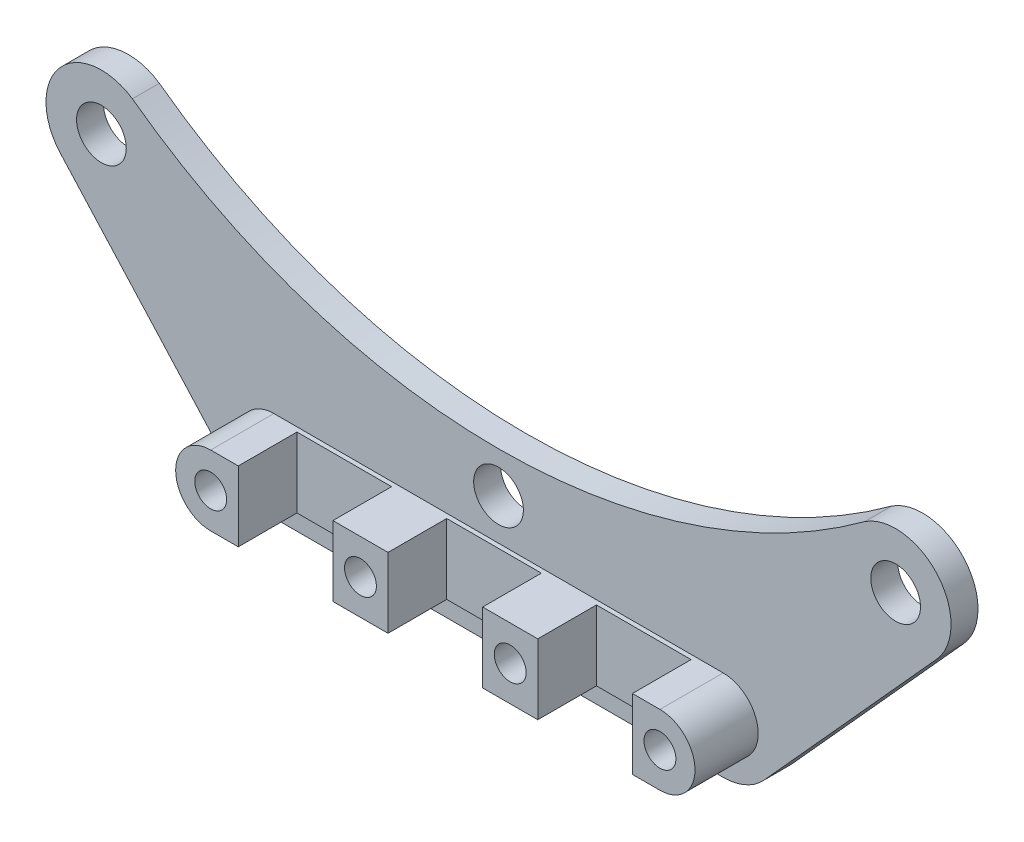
SolidWorks part; units mm, degrees
ref_plane "Front" through (0, 0, 0) normal (0, 0, 1) x (1, 0, 0)
ref_plane "Top" through (0, 0, 0) normal (0, 1, 0) x (1, 0, 0)
ref_plane "Right" through (0, 0, 0) normal (1, 0, 0) x (0, 0, -1)
sketch "Sketch1" plane through (0, 0, 0) normal (0, 0, 1) x (1, 0, 0)
  line L0 (205.3219, 64.3412) -> (219.9514, 48.1514)
  line L1 (279.6538, 64.3412) -> (265.0243, 48.1514)
  line L2 (261.5379, 46.6029) -> (223.4379, 46.6029)
  arc A0 (211.4358, 71.3874) -> (273.54, 71.3874) centre (242.4879, 113.6589) ccw
  arc A1 (219.9514, 48.1514) -> (223.4379, 46.6029) centre (223.4379, 51.3019) ccw
  arc A2 (211.716, 71.1831) -> (204.1094, 67.4916) centre (208.8084, 67.4916) ccw
  arc A3 (204.1094, 67.4916) -> (205.3219, 64.3412) centre (208.8084, 67.4916) ccw
  circle A4 centre (223.4379, 51.3019) radius 1.778 construction
  arc A5 (261.5379, 46.6029) -> (265.0243, 48.1514) centre (261.5379, 51.3019) ccw
  circle A6 centre (236.1379, 51.3019) radius 1.778 construction
  circle A7 centre (248.8379, 51.3019) radius 1.778 construction
  circle A8 centre (261.5379, 51.3019) radius 1.778 construction
  arc A9 (280.8664, 67.4916) -> (273.2598, 71.1831) centre (276.1674, 67.4916) ccw
  arc A10 (279.6538, 64.3412) -> (280.8664, 67.4916) centre (276.1674, 67.4916) ccw
  circle A11 centre (208.8084, 67.4916) radius 2.1082
  circle A12 centre (276.1674, 67.4916) radius 2.1082
  circle A13 centre (242.4879, 57.7535) radius 2.1082
extrude "Boss-Extrude1" add sketch "Sketch1" along normal blind 2.286 contours L1 A10 A9 A0 A2 A3 L0 A1 L2 A5 A13 A12 A11
sketch "Sketch2" plane through (0, 0, 2.286) normal (0, 0, 1) x (1, 0, 0)
  line L0 (233.8011, 54.2737) -> (233.8011, 48.3301)
  line L1 (225.7747, 54.2737) -> (225.7747, 48.3301)
  line L2 (246.5011, 54.2737) -> (246.5011, 48.3301)
  line L3 (238.4747, 54.2737) -> (238.4747, 48.3301)
  line L4 (251.1747, 54.2737) -> (251.1747, 48.3301)
  line L5 (259.2011, 54.2737) -> (259.2011, 48.3301)
  line L6 (261.5379, 54.2737) -> (223.4379, 54.2737)
  line L7 (261.5379, 48.3301) -> (223.4379, 48.3301)
  arc A0 (261.5379, 48.3301) -> (261.5379, 54.2737) centre (261.5379, 51.3019) ccw
  arc A1 (223.4379, 54.2737) -> (223.4379, 48.3301) centre (223.4379, 51.3019) ccw
  circle A4 centre (223.4379, 51.3019) radius 1.778 construction
  circle A5 centre (236.1379, 51.3019) radius 1.778 construction
  circle A6 centre (248.8379, 51.3019) radius 1.778 construction
  circle A7 centre (261.5379, 51.3019) radius 1.778 construction
  point P0 (0, 0)
sketch "Sketch3" plane through (0, 0, 2.286) normal (0, 0, 1) x (1, 0, 0)
  line L0 (223.4379, 54.2737) -> (259.2011, 54.2737)
  line L2 (261.5379, 48.3301) -> (223.4379, 48.3301)
  line L3 (225.7747, 54.2737) -> (225.7747, 48.3301)
  line L4 (225.7747, 48.3301) -> (233.8011, 48.3301)
  line L5 (233.8011, 48.3301) -> (233.8011, 54.2737)
  line L6 (233.8011, 54.2737) -> (238.4747, 54.2737)
  line L7 (238.4747, 54.2737) -> (238.4747, 48.3301)
  line L8 (238.4747, 48.3301) -> (246.5011, 48.3301)
  line L9 (246.5011, 48.3301) -> (246.5011, 54.2737)
  line L10 (246.5011, 54.2737) -> (251.1747, 54.2737)
  line L11 (251.1747, 54.2737) -> (251.1747, 48.3301)
  line L12 (251.1747, 48.3301) -> (259.2011, 48.3301)
  line L13 (259.2011, 48.3301) -> (259.2011, 54.2737)
  line L14 (259.2011, 54.2737) -> (261.5379, 54.2737)
  arc A0 (223.4379, 54.2737) -> (223.4379, 48.3301) centre (223.4379, 51.3019) ccw
  arc A1 (261.5379, 48.3301) -> (261.5379, 54.2737) centre (261.5379, 51.3019) ccw
extrude "Boss-Extrude2" add sketch "Sketch3" along normal blind 5.3594 contours L0 A0 L2 L3 | L2 L5 L0 L3 | L7 L0 L5 L2 | L2 L9 L0 L7 | L11 L0 L9 L2 | L2 L13 L0 L11 | L2 A1 L14 L13
hole_wizard "#6-32 Tapped Hole1" positions "Sketch4" profile "Sketch5" tap size "#6-32" standard "ANSI Inch"
sketch "Sketch4" plane through (0, 0, 0) normal (0, 0, -1) x (-1, 0, 0)
  point P0 (-261.5379, 51.3019)
  point P3 (-248.8379, 51.3019)
  point P6 (-236.1379, 51.3019)
  point P9 (-223.4379, 51.3019)
sketch "Sketch5" plane through (261.5379, 51.3019, 0) normal (1, 0, 0) x (0, 1, 0)
  line L0 (0, 0) -> (0, 7.6454)
  line L1 (0, 7.6454) -> (1.3525, 7.6454)
  line L2 (1.3525, 7.6454) -> (1.3525, 0)
  line L5 (1.3525, 0) -> (0, 0)
  line L11 (0, -6.35) -> (0, 107.95) construction
  dimension "Thru Tap Drill Dia." = 2.7051
  dimension "Thru Tap Drill Depth" = 7.6454
sketch "Sketch6" plane through (0, 0, 0) normal (0, 0, -1) x (-1, 0, 0)
  line L1 (-259.2011, 54.2737) -> (-251.1747, 54.2737)
  line L2 (-259.2011, 54.2737) -> (-259.2011, 48.3301)
  line L3 (-259.2011, 48.3301) -> (-251.1747, 48.3301)
  line L4 (-251.1747, 54.2737) -> (-251.1747, 48.3301)
  line L5 (-246.5011, 54.2737) -> (-238.4747, 54.2737)
  line L6 (-246.5011, 54.2737) -> (-246.5011, 48.3301)
  line L7 (-246.5011, 48.3301) -> (-238.4747, 48.3301)
  line L8 (-238.4747, 54.2737) -> (-238.4747, 48.3301)
  line L9 (-233.8011, 54.2737) -> (-225.7747, 54.2737)
  line L10 (-233.8011, 54.2737) -> (-233.8011, 48.3301)
  line L11 (-233.8011, 48.3301) -> (-225.7747, 48.3301)
  line L12 (-225.7747, 54.2737) -> (-225.7747, 48.3301)
extrude "Cut-Extrude1" cut sketch "Sketch6" along normal blind 4.9784 from surface at -7.6454
